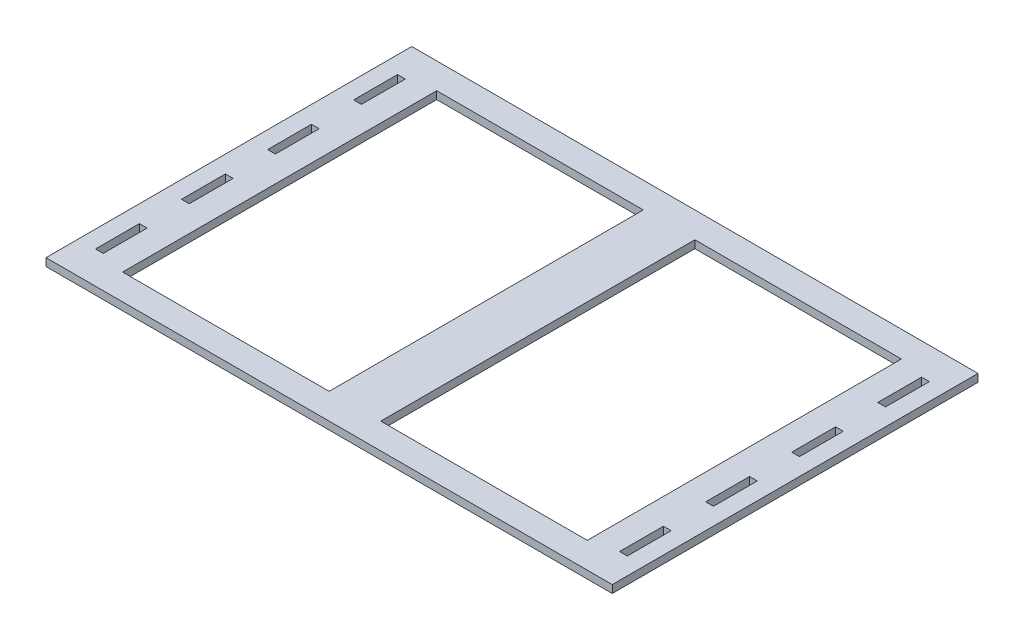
SolidWorks part; units mm, degrees
ref_plane "Front Plane" through (0, 0, 0) normal (0, 0, 1) x (1, 0, 0)
ref_plane "Top Plane" through (0, 0, 0) normal (0, 1, 0) x (1, 0, 0)
ref_plane "Right Plane" through (0, 0, 0) normal (1, 0, 0) x (0, 0, -1)
sketch "Sketch1" plane through (0, 0, 0) normal (0, 1, 0) x (1, 0, 0)
  line L1 (-329, 212.5) -> (329, 212.5)
  line L2 (-329, 212.5) -> (-329, -212.5)
  line L3 (-329, -212.5) -> (329, -212.5)
  line L4 (329, 212.5) -> (329, -212.5)
  dimension "D2" = 658
  dimension "D3" = 425
extrude "Boss-Extrude1" add sketch "Sketch1" along normal blind 9
sketch "Sketch2" plane through (0, 0, 0) normal (0, 1, 0) x (1, 0, 0)
  line L0 (329, -212.5) -> (329, 212.5) construction
  line L1 (300, 176) -> (309, 176)
  line L2 (300, 176) -> (300, 125)
  line L3 (300, 125) -> (309, 125)
  line L4 (309, 176) -> (309, 125)
  line L5 (329, 212.5) -> (-329, 212.5) construction
  point P4 (300, 150.5)
  dimension "D1" = 9
  dimension "D2" = 51
  dimension "D3" = 20
  dimension "D4" = 36.5
extrude "Cut-Extrude3" cut sketch "Sketch2" along normal through all
pattern_linear "LPattern1" count 4 spacing 100 along (0, 0, 1) of "Cut-Extrude3"
sketch "Sketch3" plane through (0, 9, 0) normal (0, 1, 0) x (1, 0, 0)
  line L0 (-329, 212.5) -> (-329, -212.5) construction
  line L1 (-309, 176) -> (-300, 176)
  line L2 (-309, 176) -> (-309, 125)
  line L3 (-309, 125) -> (-300, 125)
  line L4 (-300, 176) -> (-300, 125)
  line L5 (329, 212.5) -> (-329, 212.5) construction
  dimension "D1" = 51
  dimension "D2" = 9
  dimension "D3" = 20
  dimension "D4" = 36.5
extrude "Cut-Extrude4" cut sketch "Sketch3" against normal through all
pattern_linear "LPattern2" count 4 spacing 100 along (0, 0, 1) of "Cut-Extrude4"
sketch "Sketch4" plane through (0, 0, 0) normal (0, 1, 0) x (1, 0, 0)
  line L0 (0, -341.3123) -> (0, 422.6534) construction
  line L1 (-329, -212.5) -> (329, -212.5) construction
  line L2 (-270, 182.5) -> (-30, 182.5)
  line L3 (-270, 182.5) -> (-270, -182.5)
  line L4 (-270, -182.5) -> (-30, -182.5)
  line L5 (-30, 182.5) -> (-30, -182.5)
  line L6 (329, 212.5) -> (-329, 212.5) construction
  line L7 (-300, 125) -> (-300, 176) construction
  dimension "D1" = 30
  dimension "D2" = 30
  dimension "D3" = 30
  dimension "D4" = 30
extrude "Cut-Extrude6" cut sketch "Sketch4" along normal through all
pattern_linear "LPattern3" count 2 spacing 300 along (1, 0, 0) of "Cut-Extrude6"
